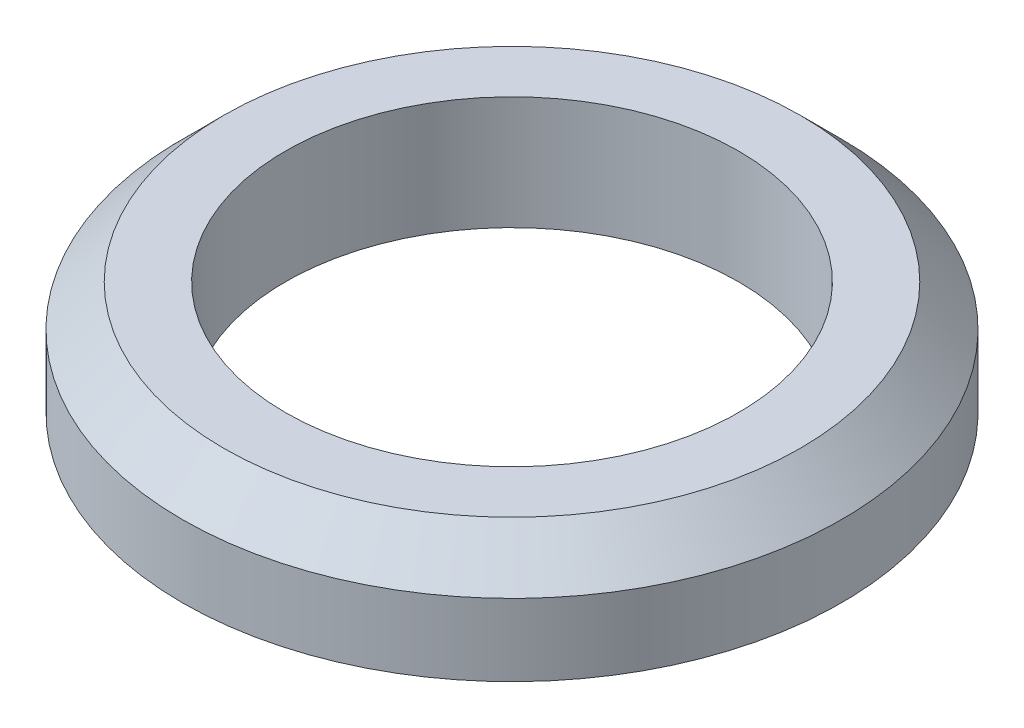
SolidWorks part; units mm, degrees
ref_plane "Plan1" through (0, 0, 0) normal (0, 0, 1) x (1, 0, 0)
ref_plane "Plan2" through (0, 0, 0) normal (0, 1, 0) x (1, 0, 0)
ref_plane "Plan3" through (0, 0, 0) normal (1, 0, 0) x (0, 0, -1)
sketch "Esquisse1" plane through (0, 0, 0) normal (0, 1, 0) x (1, 0, 0)
  circle A0 centre (0, 0) radius 5.5
  circle A1 centre (0, 0) radius 8
  dimension "D1" = 11
  dimension "D2" = 16
extrude "Base-Extrusion" add sketch "Esquisse1" along normal mid plane 2.75
chamfer "Chanfrein1" distance 1 angle 45
